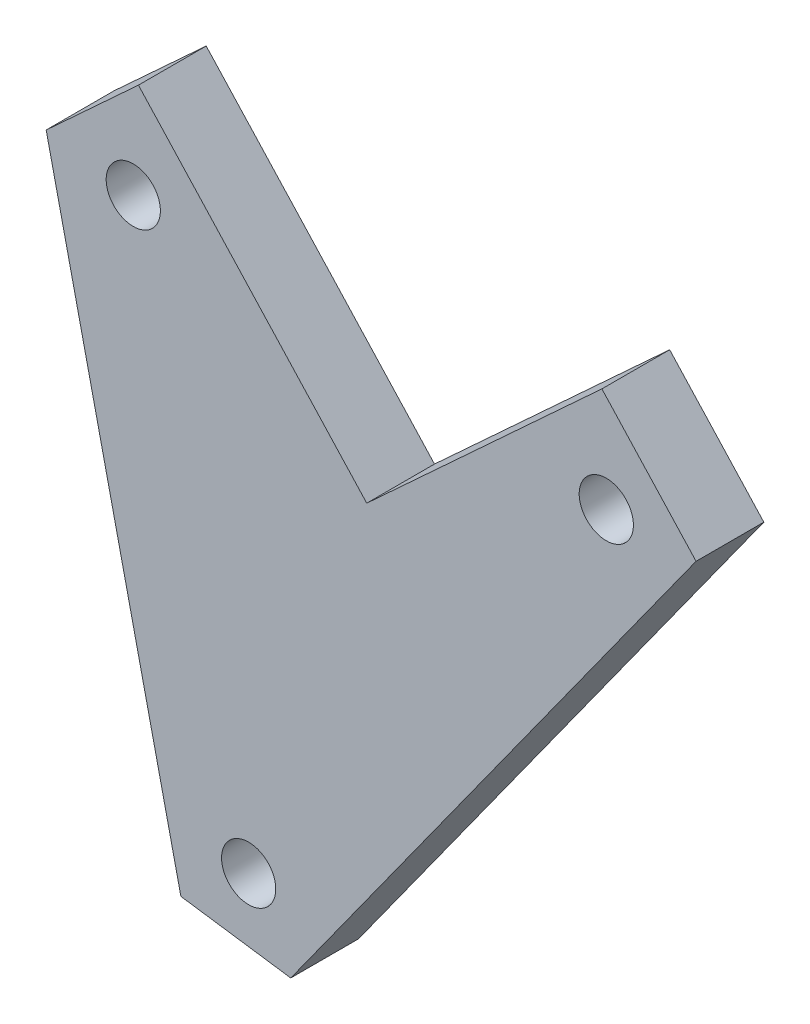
SolidWorks part; units mm, degrees
ref_plane "Front Plane" through (0, 0, 0) normal (0, 0, 1) x (1, 0, 0)
ref_plane "Top Plane" through (0, 0, 0) normal (0, 1, 0) x (1, 0, 0)
ref_plane "Right Plane" through (0, 0, 0) normal (1, 0, 0) x (0, 0, -1)
sketch "Sketch1" plane through (0, 0, 0) normal (0, 0, 1) x (1, 0, 0)
  line L0 (3.9427, -6.516) -> (41.9254, 46.2916)
  line L1 (41.9254, 46.2916) -> (33.1021, 55.8725)
  line L2 (33.1021, 55.8725) -> (11.0653, 35.5782)
  line L3 (11.0653, 35.5782) -> (-10.3274, 58.8076)
  line L4 (-10.3274, 58.8076) -> (-18.973, 50.8457)
  line L5 (-18.973, 50.8457) -> (-6.3496, -5.0405)
  line L6 (-6.3496, -5.0405) -> (3.9427, -6.516)
  circle A0 centre (-10.8097, 49.6366) radius 2.54
  circle A1 centre (33.5143, 46.2916) radius 2.54
  circle A2 centre (0, 0) radius 2.54
  point P0 (0, 0)
  point P1 (33.5143, 46.2916)
  point P3 (-10.8097, 49.6366)
  dimension "D4" = 5.08
  dimension "D5" = 5.08
  dimension "D6" = 5.08
  dimension "D1" = 50.8
  dimension "D2" = 57.15
  dimension "D3" = 44.45
extrude "Boss-Extrude1" add sketch "Sketch1" along normal blind 6.35
